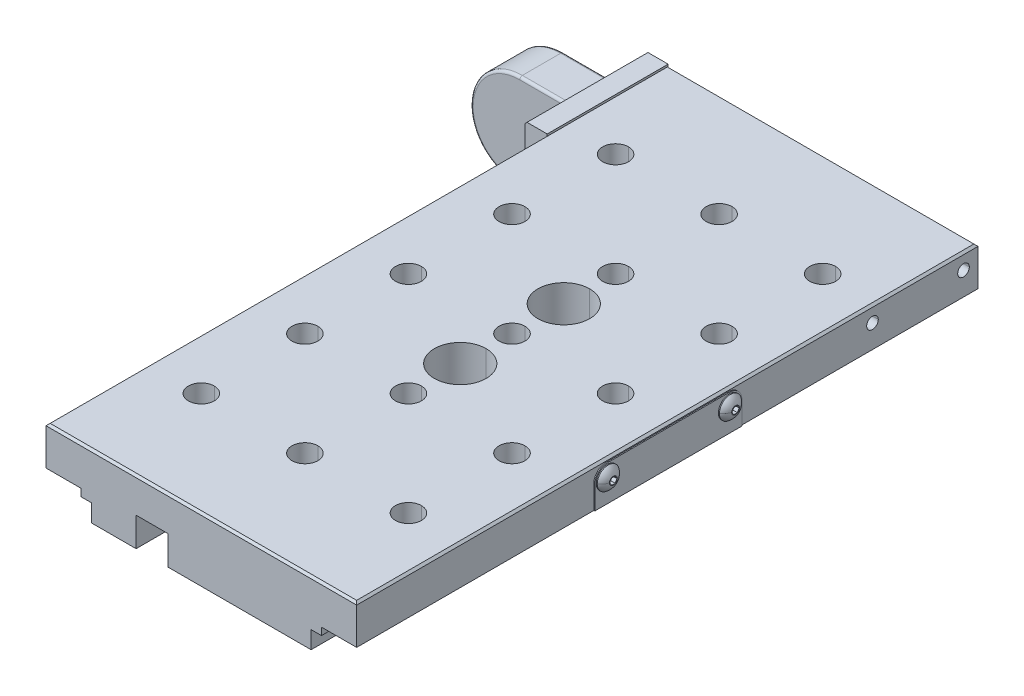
SolidWorks part; units mm, degrees
ref_plane "Plan de face" through (0, 0, 0) normal (0, 0, 1) x (1, 0, 0)
ref_plane "Plan de dessus" through (0, 0, 0) normal (0, 1, 0) x (1, 0, 0)
ref_plane "Plan de droite" through (0, 0, 0) normal (1, 0, 0) x (0, 0, -1)
imported_body "Newport-443.stp"
sketch "Esquisse2" plane through (0, 0, 152.4) normal (0, 0, 1) x (1, 0, 0)
  line L0 (-38.1, 0.508) -> (-38.1, 15.875) construction
  line L1 (-38.1, 9.8186) -> (40.6463, 9.8186)
  line L3 (-38.1, 9.8186) -> (-38.1, 9.579)
  line L5 (-38.1, 9.579) -> (40.6463, 9.579)
  line L7 (40.6463, 9.8186) -> (40.6463, 9.579)
  line L9 (0, 9.579) -> (5.1562, 9.579) construction
extrude "Enlèv. mat.-Extru.1" cut sketch "Esquisse2" against normal through all
delete or keep bodies "Corps-Supprimer/Garder 1" [suppressed] type delete bodies bodies 103
delete or keep bodies "Corps-Supprimer/Garder 2" [suppressed] type delete bodies bodies 102
delete or keep bodies "Corps-Supprimer/Garder 4" [suppressed] type delete bodies bodies 102
delete or keep bodies "Corps-Supprimer/Garder 6" [suppressed] type delete bodies bodies 103
delete or keep bodies "Corps-Supprimer/Garder 7" type delete bodies bodies 102
delete or keep bodies "Corps-Supprimer/Garder 8" type delete bodies bodies 107 106 105 104
